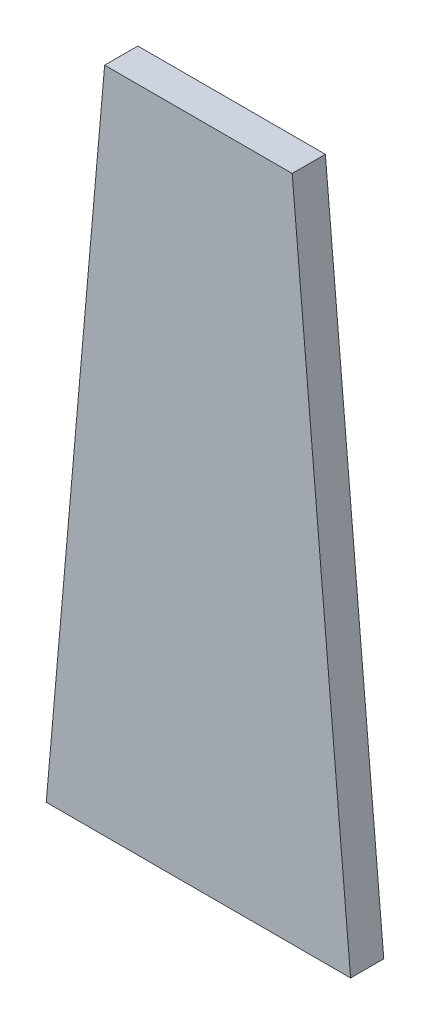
SolidWorks part; units mm, degrees
ref_plane "Front" through (0, 0, 0) normal (0, 0, 1) x (1, 0, 0)
ref_plane "Top" through (0, 0, 0) normal (0, 1, 0) x (1, 0, 0)
ref_plane "Right" through (0, 0, 0) normal (1, 0, 0) x (0, 0, -1)
sketch "Sketch1" plane through (0, 0, 0) normal (0, 0, 1) x (1, 0, 0)
  line L0 (-5.6532, 20.1218) -> (5.6532, 20.1218)
  line L1 (5.6532, 20.1218) -> (9.174, -20.1218)
  line L2 (9.174, -20.1218) -> (-9.174, -20.1218)
  line L3 (-9.174, -20.1218) -> (-5.6532, 20.1218)
extrude "Boss-Extrude1" add sketch "Sketch1" along normal blind 2
